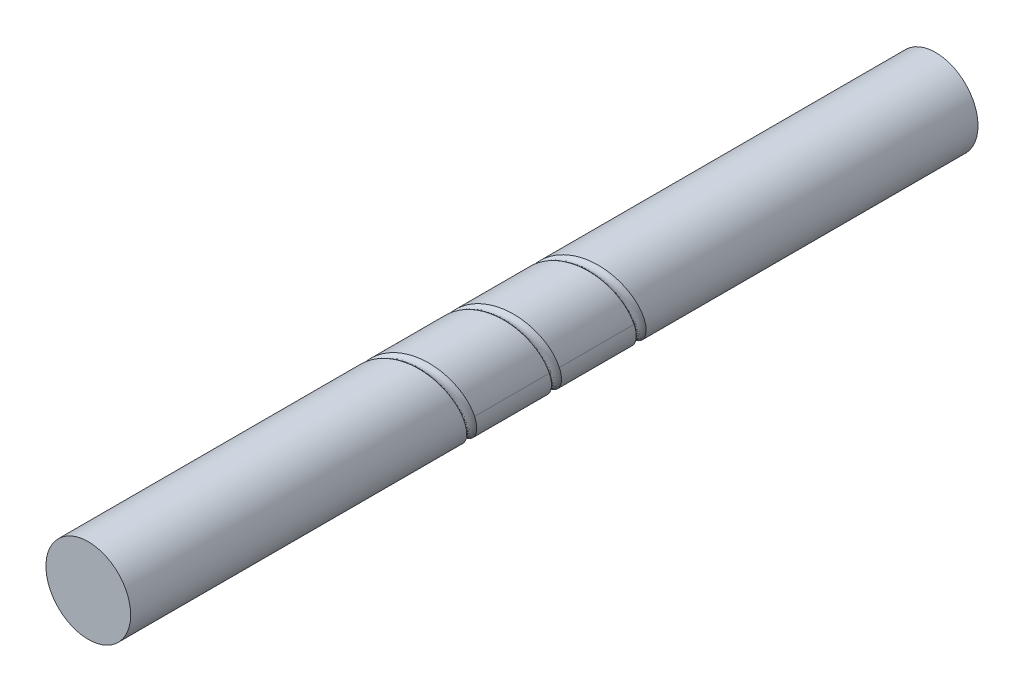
SolidWorks part; units mm, degrees
ref_plane "Front Plane" through (0, 0, 0) normal (0, 0, 1) x (1, 0, 0)
ref_plane "Top Plane" through (0, 0, 0) normal (0, 1, 0) x (1, 0, 0)
ref_plane "Right Plane" through (0, 0, 0) normal (1, 0, 0) x (0, 0, -1)
sketch "Sketch1" plane through (0, 0, 0) normal (0, 0, 1) x (1, 0, 0)
  circle A0 centre (0, 0) radius 25
  dimension "D1" = 50
extrude "Boss-Extrude1" add sketch "Sketch1" along normal blind 500
ref_plane "Plane1" through (0, 0, 175) normal (0, 0, 1) x (1, 0, 0)
sketch "Sketch2" plane through (0, 0, 175) normal (0, 0, 1) x (1, 0, 0)
  circle A0 centre (0, 0) radius 27.646
  dimension "D1" = 55.292
curve "Helix/Spiral1"
sketch "Sketch3" plane through (0, 0, 0) normal (0, 1, 0) x (1, 0, 0)
  circle A0 centre (-27.646, -175) radius 3.969
  spline S0 degree 3 number of poles 74 (-27.646, -175) -> (-27.646, -325) construction
  dimension "D1" = 7.938
sweep "Cut-Sweep1" cut profiles "Sketch3" path "Helix/Spiral1"
pattern_linear "LPattern1" [suppressed] count 2 spacing 500
